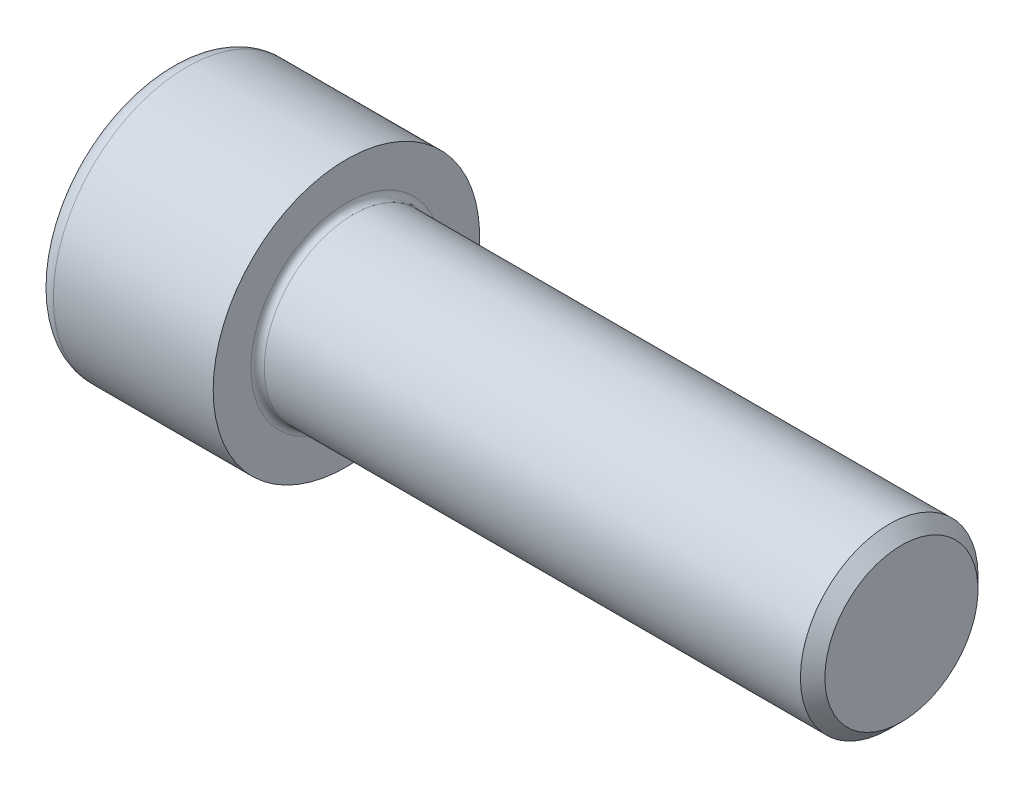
SolidWorks part; units mm, degrees
ref_plane "Plane1" through (0, 0, 0) normal (0, 0, 1) x (1, 0, 0)
ref_plane "Plane2" through (0, 0, 0) normal (0, 1, 0) x (1, 0, 0)
ref_plane "Plane3" through (0, 0, 0) normal (1, 0, 0) x (0, 0, -1)
sketch "BodySke" plane through (0, 0, 0) normal (0, 0, 1) x (1, 0, 0)
  line L0 (0, 0) -> (0, 12)
  line L1 (0, 12) -> (16, 12)
  line L2 (16, 12) -> (16, 8)
  line L3 (16, 8) -> (64.8985, 8)
  line L4 (66, 6.8985) -> (66, 0)
  line L5 (66, 0) -> (0, 0)
  line L6 (-31.75, 0) -> (127, 0) construction
  line L8 (66, 6.8985) -> (64.8985, 8)
  line L10 (66, -6.8985) -> (64.8985, -8) construction
  line L11 (18, 9.525) -> (18, 3.175) construction
  line L12 (16, 9.525) -> (16, 3.175) construction
  line L13 (6, 9.525) -> (6, 3.175) construction
  dimension "Diameter" = 16
  dimension "Head_ht" = 16
  dimension "Length" = 50
  dimension "Body_ch_ang" = 45
  dimension "Head_dia" = 24
  dimension "Minor_dia" = 13.797
  dimension "Advance" = 2
  dimension "Thread_nom" = 50
  dimension "Thread_length" = 60
revolve "Base-Revolve" add sketch "BodySke"
fillet "Fillet1" radius 0.6 1 edges at (16, 0, 8)
fillet "Fillet2" radius 1.6 1 edges at (0, 0, 12)
sketch "Sketch2" plane through (0, 0, 0) normal (0, 0, 1) x (1, 0, 0)
  line L0 (0, 7.016) -> (8, 7.016)
  line L1 (8, 7.016) -> (12.0507, 0)
  line L2 (-31.75, 0) -> (127, 0) construction
  line L3 (12.0507, 0) -> (0, 0)
  line L4 (0, 0) -> (0, 7.016)
  line L6 (0, 0) -> (47.625, 0) construction
  dimension "D1" = 7.016
  dimension "D2" = 60
  dimension "Depth" = 8
revolve "Hex-PreBroach" cut sketch "Sketch2" angle 360 about L6
sketch "Sketch3" plane through (0, 0, 0) normal (-1, 0, 0) x (0, 0.5, 0.866)
  line L0 (4.0507, 7.016) -> (-4.0507, 7.016)
  line L1 (-4.0507, 7.016) -> (-8.1014, 0)
  line L2 (4.0507, 7.016) -> (8.1014, 0)
  line L3 (4.0507, -7.016) -> (8.1014, 0)
  line L4 (4.0507, -7.016) -> (-4.0507, -7.016)
  line L5 (-4.0507, -7.016) -> (-8.1014, 0)
  dimension "D1" = 7.016
  dimension "D2" = 7.016
  dimension "Hex_size" = 14.032
extrude "Hex" cut sketch "Sketch3" against normal blind 8
sketch "ThdSchSke" plane through (0, 0, 0) normal (0, 0, 1) x (1, 0, 0)
  line L0 (22, -6.8985) -> (21.2287, -8)
  line L1 (22, -6.8985) -> (22.7713, -8)
  line L2 (22.7713, -8) -> (22.7713, -10)
  line L3 (-3.175, 0) -> (5.1513, 0) construction
  line L4 (0, 10.4) -> (0, -10.4) construction
  line L5 (22.7713, -10) -> (21.2287, -10)
  line L6 (21.2287, -10) -> (21.2287, -8)
  dimension "Thread_minor" = 13.797
  dimension "Diameter" = 16
  dimension "Start" = 22
  dimension "SideAngle" = 55
  dimension "VeeAngle" = 70
  dimension "Overcut" = 20
revolve "ThreadSchematic" [suppressed] cut sketch "ThdSchSke" angle 360 about L3
pattern_linear "ThdSchPat" [suppressed]
equation "\"D2@Sketch3\" = \"Hex_size@Sketch3\" / 2"
equation "\"D1@Sketch3\" = \"Hex_size@Sketch3\" / 2"
equation "\"D1@Sketch2\" = \"Hex_size@Sketch3\" / 2"
equation "\"Thread_minor@ThreadCosmetic\"  =  \"Minor_dia@BodySke\""
equation "\"Depth@Sketch2\" =  \"Key_eng@Hex\""
equation "\"Thread_length@ThreadCosmetic\" = ((sgn( (\"Length@BodySke\" - \"Advance@BodySke\" * 3.0) - \"Thread_nom@BodySke\" )-1)*( (\"Length@BodySke\" - \"Advance@BodySke\" * 3.0) - \"Thread_nom@BodySke\" ))/-2+ \"Thread_no"
equation "\"Thread_minor@ThdSchSke\" = \"Minor_dia@BodySke\""
equation "\"Diameter@ThdSchSke\" = \"Diameter@BodySke\""
equation "\"Overcut@ThdSchSke\" = \"Diameter@BodySke\" * 1.25"
equation "\"Start@ThdSchSke\" = \"Head_ht@BodySke\" + \"Length@BodySke\" - \"Thread_length@ThreadCosmetic\"  '---Non-countersunk---"
equation "\"Num_threads@ThdSchPat\" = int( \"Thread_length@ThreadCosmetic\" / \"Advance@BodySke\" + 0.999 )  + 1"
equation "\"Advance@ThdSchPat\" = \"Thread_length@ThreadCosmetic\" /  (\"Num_threads@ThdSchPat\" - 1) 'relax it"
equation "\"Num_threads@ThdSchPat\" = \"Num_threads@ThdSchPat\" - sgn( \"Num_threads@ThdSchPat\" - 1) '---chamfered tips only---"
